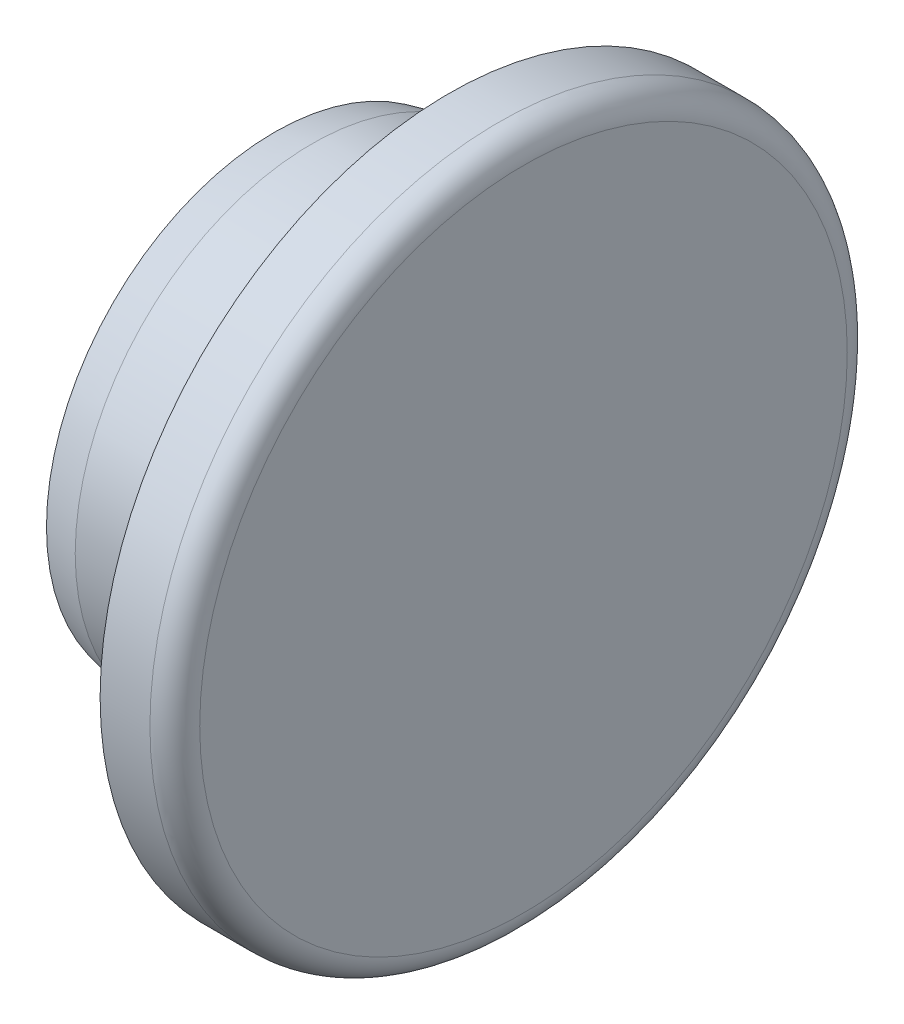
SolidWorks part; units mm, degrees
ref_plane "Front Plane" through (0, 0, 0) normal (0, 0, 1) x (1, 0, 0)
ref_plane "Top Plane" through (0, 0, 0) normal (0, 1, 0) x (1, 0, 0)
ref_plane "Right Plane" through (0, 0, 0) normal (1, 0, 0) x (0, 0, -1)
sketch "Esquisse1" plane through (0, 0, 0) normal (0, 0, 1) x (1, 0, 0)
  line L0 (0, 9.5) -> (7, 9.5)
  line L1 (7, 7) -> (7, 0)
  line L2 (0, 7) -> (7, 7)
  line L3 (10, 0) -> (10, 14)
  line L4 (7, 9.5) -> (7, 14)
  line L5 (0, 7) -> (0, 9.5)
  line L6 (-7.2154, 0) -> (12.7386, 0) construction
  line L7 (7, 14) -> (10, 14)
  line L8 (7, 0) -> (10, 0)
  dimension "D1" = 3
  dimension "D2" = 2.5
  dimension "D3" = 9.5
  dimension "D4" = 14
  dimension "D5" = 7
revolve "Révolution1" add sketch "Esquisse1" angle 360 about L6
fillet "Congé1" radius 1 1 edges at (10, 0, 14)
chamfer "Chanfrein1" distance 1.5 angle 13 1 edges at (0, 0, 9.5)
